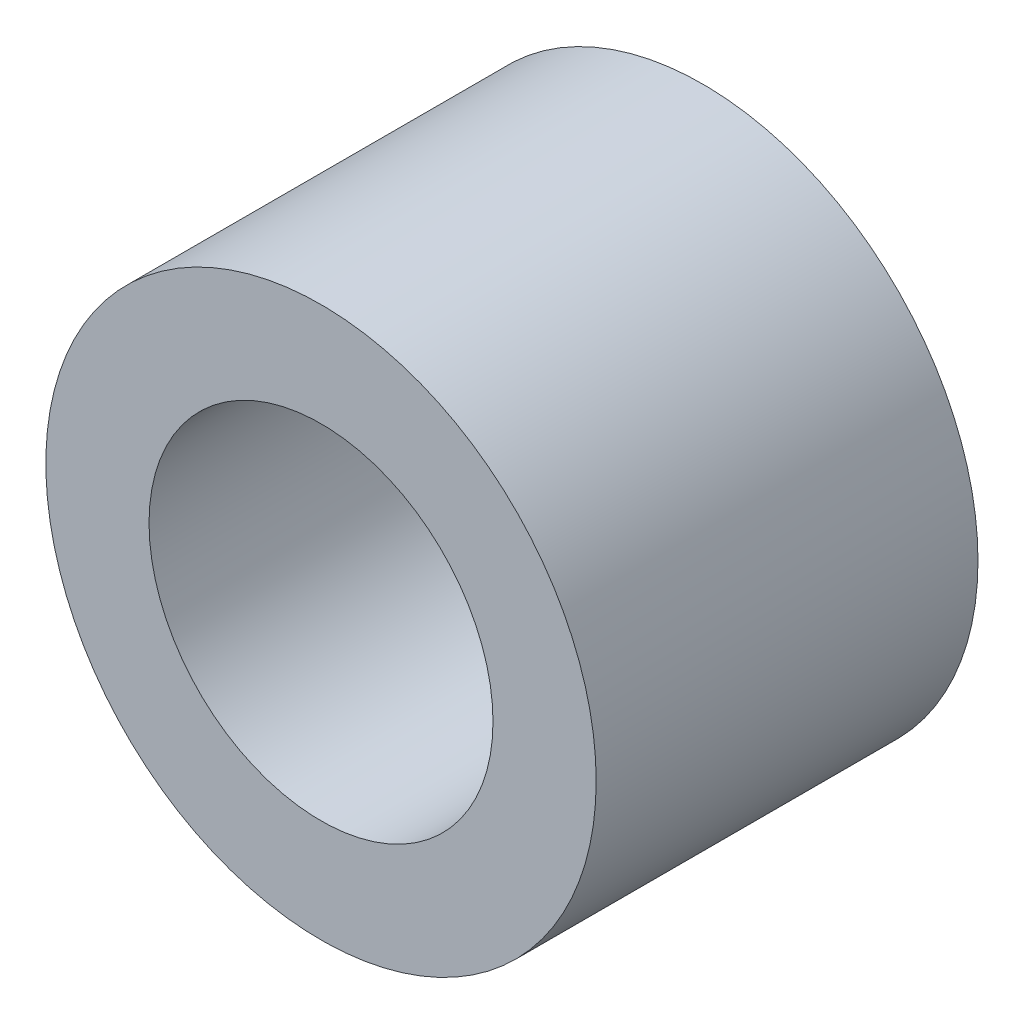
SolidWorks part; units mm, degrees
ref_plane "Front" through (0, 0, 0) normal (0, 0, 1) x (1, 0, 0)
ref_plane "Top" through (0, 0, 0) normal (0, 1, 0) x (1, 0, 0)
ref_plane "Right" through (0, 0, 0) normal (1, 0, 0) x (0, 0, -1)
sketch "Sketch1" plane through (0, 0, 0) normal (0, 0, 1) x (1, 0, 0)
  circle A0 centre (0, 0) radius 40
  circle A1 centre (0, 0) radius 25
  dimension "D1" = 80
  dimension "D2" = 50
extrude "Boss-Extrude1" add sketch "Sketch1" along normal blind 55.5
